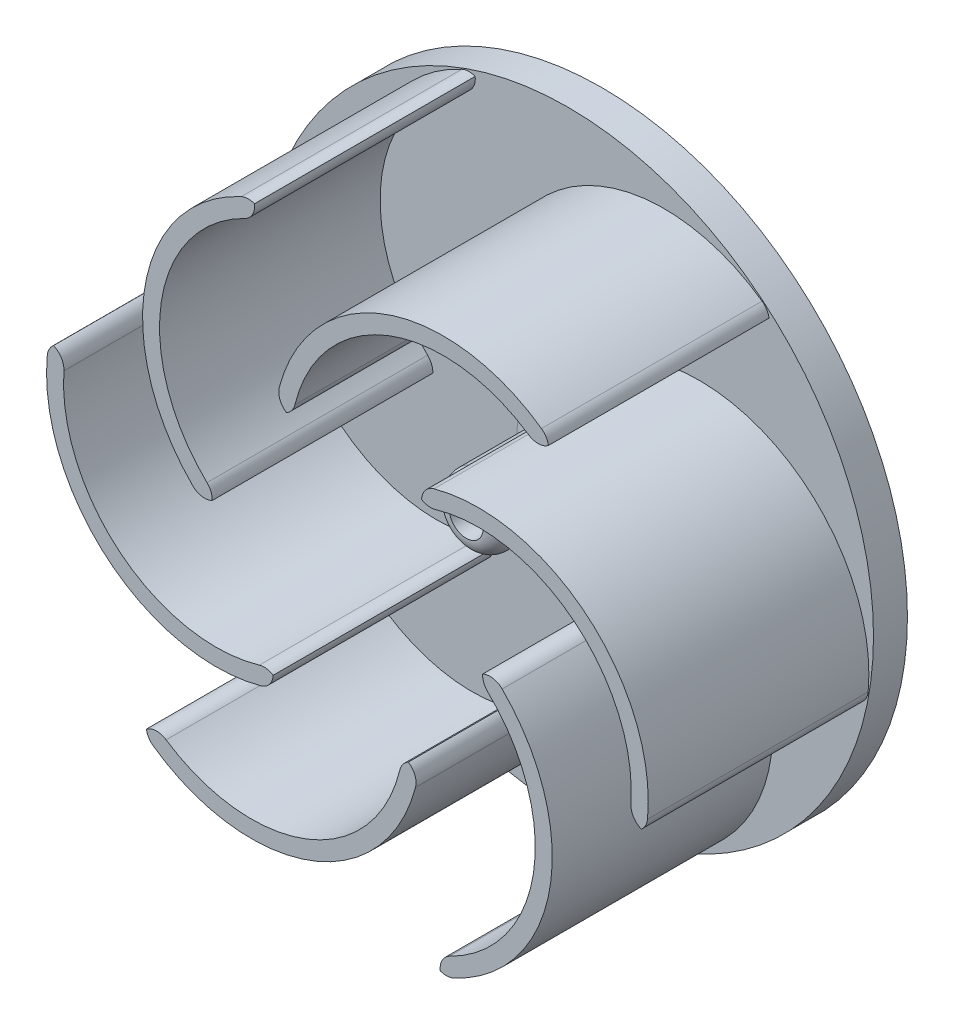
SolidWorks part; units mm, degrees
ref_plane "Front Plane" through (0, 0, 0) normal (0, 0, 1) x (1, 0, 0)
ref_plane "Top Plane" through (0, 0, 0) normal (0, 1, 0) x (1, 0, 0)
ref_plane "Right Plane" through (0, 0, 0) normal (1, 0, 0) x (0, 0, -1)
sketch "Sketch2" plane through (0, 0, 0) normal (0, 0, 1) x (1, 0, 0)
  circle A0 centre (0, 0) radius 18
  circle A1 centre (0, 0) radius 1
  dimension "D1" = 36
  dimension "D2" = 2
extrude "Boss-Extrude1" add sketch "Sketch2" against normal blind 2
sketch "Sketch3" plane through (0, 0, 0) normal (0, 0, 1) x (1, 0, 0)
  line L0 (0, 0) -> (15.202, 15.202) construction
  line L1 (-4.2824, 6.7573) -> (-3.1846, 7.3388)
  line L2 (12.0208, 12.0208) -> (11.7807, 13.5624)
  circle A0 centre (0, 0) radius 8 construction
  arc A1 (11.7807, 13.5624) -> (-4.2824, 6.7573) centre (5.6569, 5.6569) ccw
  circle A2 centre (0, 0) radius 18 construction
  arc A3 (12.0208, 12.0208) -> (-3.1846, 7.3388) centre (5.6569, 5.6569) ccw
  arc A5 (12.7279, 12.7279) -> (-4.2824, 6.7573) centre (5.6569, 5.6569) ccw construction
  arc A6 (12.0208, 12.0208) -> (-3.2885, 6.6472) centre (5.6569, 5.6569) ccw construction
  dimension "D1" = 16
  dimension "D2" = 1
extrude "Boss-Extrude2" add sketch "Sketch3" along normal blind 13
fillet "Fillet1" radius 1 2 edges at (11.7807, 13.5624, 6.5) (-3.1846, 7.3388, 6.5)
fillet "Fillet2" radius 1 2 edges at (12.0208, 12.0208, 6.5) (-4.2824, 6.7573, 6.5)
pattern_circular "CirPattern1" count 6 over 360 about axis through (0, 0, 0) along (0, 0, 1) of "Fillet2", "Boss-Extrude2", "Fillet1"
sketch "Sketch5" plane through (0, 0, 0) normal (0, 0, 1) x (1, 0, 0)
  circle A0 centre (0, 0) radius 1
  circle A1 centre (0, 0) radius 2
  dimension "D1" = 4
  dimension "D2" = 2
extrude "Boss-Extrude3" add sketch "Sketch5" along normal blind 6
fillet "Fillet6" radius 1 2 edges at (2, 0, 6) (2, 0, 0)
